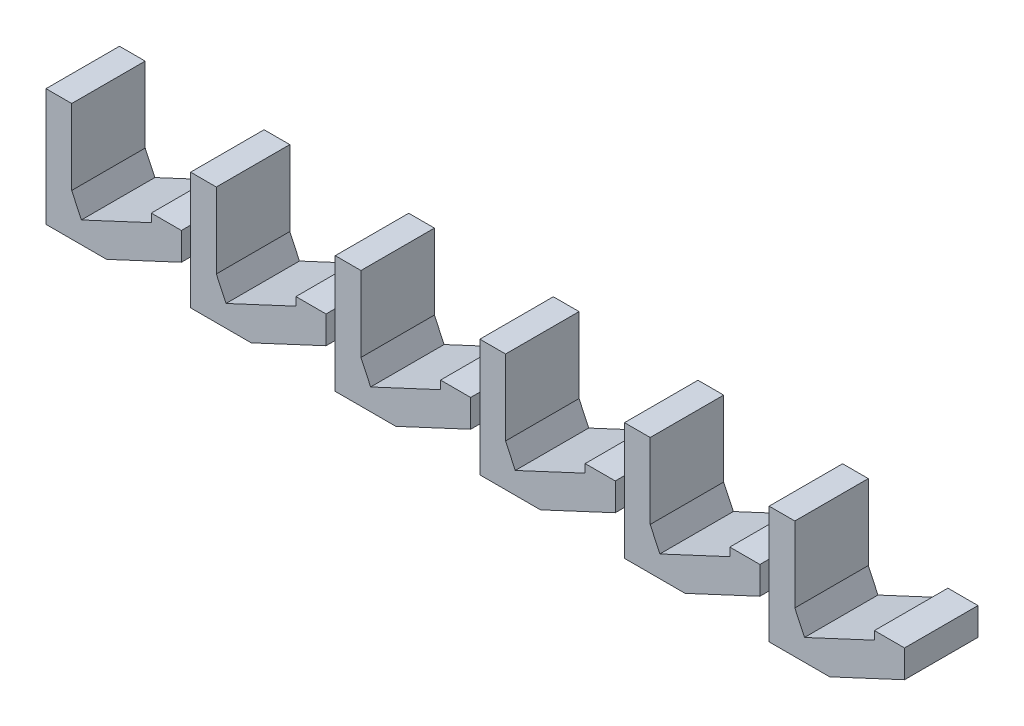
SolidWorks part; units mm, degrees
ref_plane "Front Plane" through (0, 0, 0) normal (0, 0, 1) x (1, 0, 0)
ref_plane "Top Plane" through (0, 0, 0) normal (0, 1, 0) x (1, 0, 0)
ref_plane "Right Plane" through (0, 0, 0) normal (1, 0, 0) x (0, 0, -1)
sketch "Sketch3" plane through (0, 0, 0) normal (0, 0, 1) x (1, 0, 0)
  line L0 (109.5011, 80.394) -> (109.5011, 58.804)
  line L1 (109.5011, 58.804) -> (62.6853, 58.804)
  line L2 (99.0871, 77.5165) -> (99.0871, 80.394)
  line L3 (99.0871, 80.394) -> (109.5011, 80.394)
  line L4 (99.0871, 77.5165) -> (74.9158, 66.2453)
  line L5 (74.9158, 66.2453) -> (73.574, 69.1228)
  line L6 (73.574, 69.1228) -> (71.5753, 73.409)
  line L7 (97.7453, 80.394) -> (99.0871, 80.394) construction
  line L8 (73.574, 69.1228) -> (97.7453, 80.394) construction
  line L9 (99.0871, 77.5165) -> (97.7453, 80.394) construction
  line L10 (74.9158, 66.2453) -> (109.5011, 66.2453) construction
  line L11 (71.5753, 73.409) -> (71.5753, 99.444)
  line L12 (71.5753, 99.444) -> (62.6853, 99.444)
  line L13 (62.6853, 99.444) -> (62.6853, 58.804)
  dimension "D1" = 26.67
  dimension "D2" = 3.175
  dimension "D3" = 21.59
  dimension "D4" = 25
  dimension "D5" = 6.985
  dimension "D6" = 8.89
  dimension "D7" = 10.414
  dimension "D8" = 40.64
sketch "Sketch7" plane through (0, 0, 0) normal (0, 0, 1) x (1, 0, 0)
  line L1 (-192.2487, 103.8396) -> (112.5513, 103.8396)
  line L2 (-192.2487, 103.8396) -> (-192.2487, 53.0396)
  line L3 (-192.2487, 53.0396) -> (112.5513, 53.0396)
  line L4 (112.5513, 103.8396) -> (112.5513, 53.0396)
  dimension "D1" = 304.8
  dimension "D2" = 50.8
extrude "Extrude1" add sketch "Sketch3" along normal blind 25.4
sketch "Sketch8" plane through (0, 0, 25.4) normal (0, 0, 1) x (1, 0, 0)
  line L0 (109.5011, 70.869) -> (83.6276, 58.804)
  line L1 (109.5011, 58.804) -> (109.5011, 80.394) construction
  line L2 (62.6853, 58.804) -> (109.5011, 58.804) construction
  line L3 (83.6276, 58.804) -> (109.5011, 58.804)
  line L4 (109.5011, 58.804) -> (109.5011, 70.869)
  line L5 (99.0871, 77.5165) -> (74.9158, 66.2453) construction
  dimension "D1" = 9.525
extrude "Cut-Extrude1" cut sketch "Sketch8" against normal through all
pattern_linear "LPattern1" count 6 spacing 50 along (-1, 0, 0) of "Cut-Extrude1", "Extrude1"
